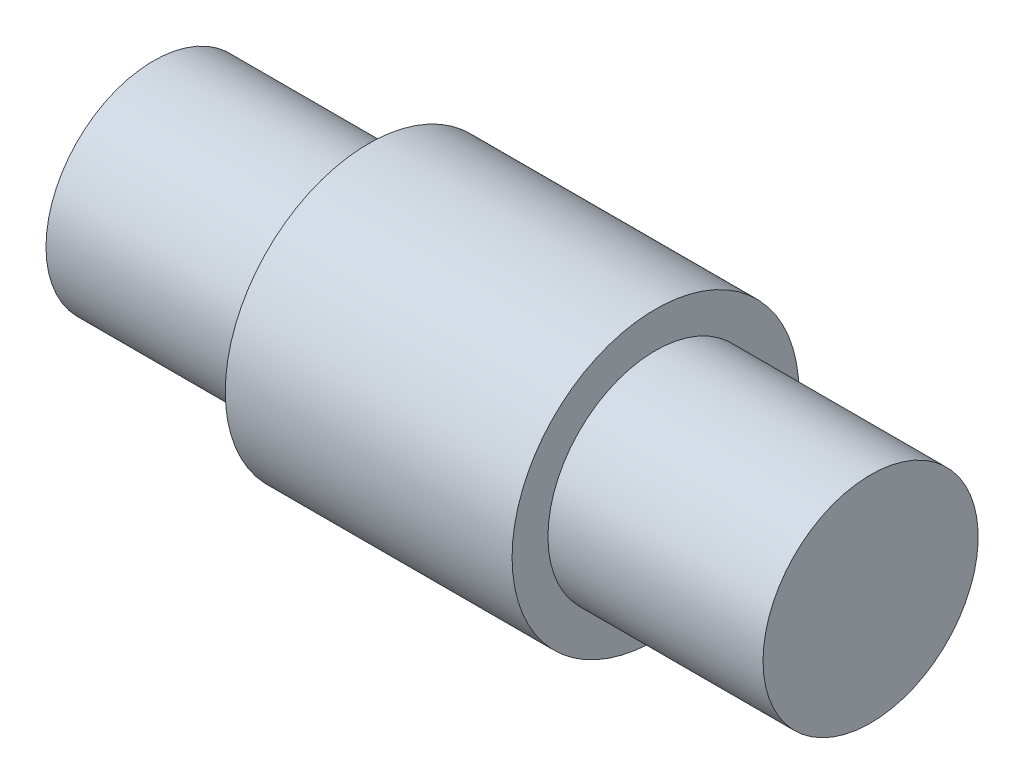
SolidWorks part; units mm, degrees
ref_plane "Front Plane" through (0, 0, 0) normal (0, 0, 1) x (1, 0, 0)
ref_plane "Top Plane" through (0, 0, 0) normal (0, 1, 0) x (1, 0, 0)
ref_plane "Right Plane" through (0, 0, 0) normal (1, 0, 0) x (0, 0, -1)
sketch "Sketch2" plane through (0, 0, 0) normal (0, 0, 1) x (1, 0, 0)
  line L0 (-8.5915, 0) -> (11.4085, 0)
  line L1 (11.4085, 0) -> (11.4085, -3)
  line L2 (11.4085, -3) -> (5.4085, -3)
  line L3 (5.4085, -3) -> (5.4085, -4)
  line L4 (5.4085, -4) -> (-2.5915, -4)
  line L5 (-2.5915, -4) -> (-2.5915, -3)
  line L6 (-2.5915, -3) -> (-8.5915, -3)
  line L7 (-8.5915, -3) -> (-8.5915, 0)
  dimension "D1" = 20
  dimension "D2" = 6
  dimension "D3" = 6
  dimension "D4" = 3
  dimension "D5" = 1
revolve "Revolve1" add sketch "Sketch2" angle 360 about L0
